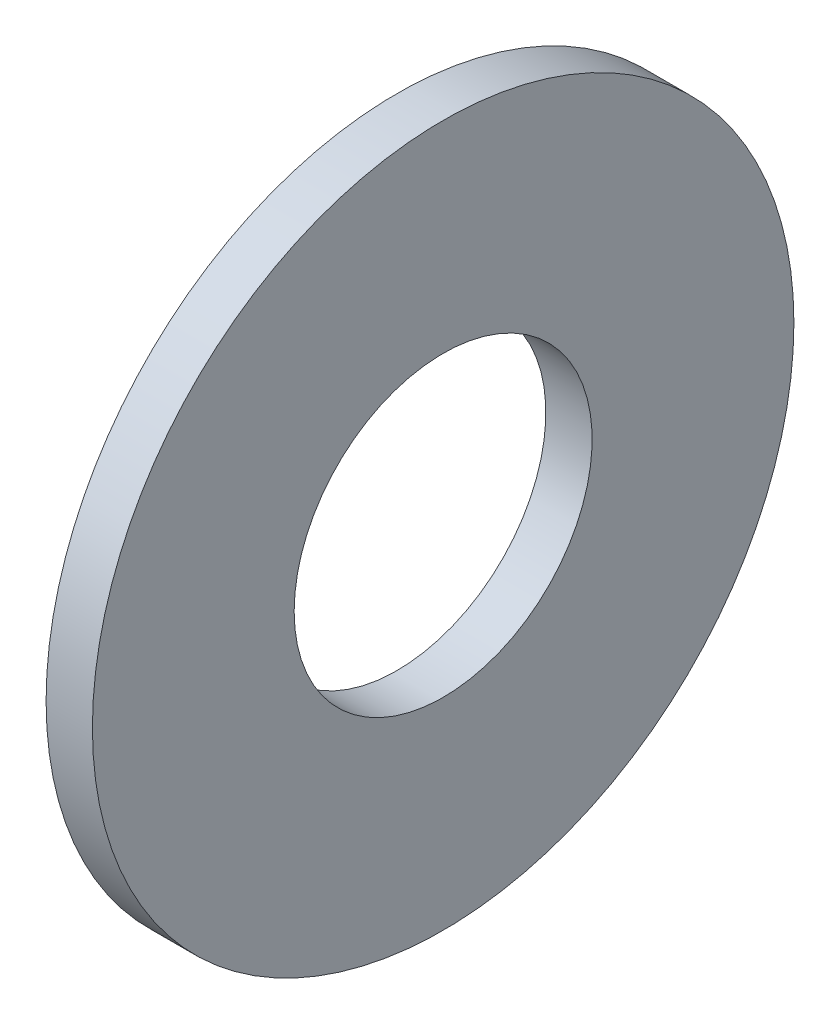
SolidWorks part; units mm, degrees
ref_plane "Plane1" through (0, 0, 0) normal (0, 0, 1) x (1, 0, 0)
ref_plane "Plane2" through (0, 0, 0) normal (0, 1, 0) x (1, 0, 0)
ref_plane "Plane3" through (0, 0, 0) normal (1, 0, 0) x (0, 0, -1)
other "Configuration Table"
sketch "Sketch1" plane through (0, 0, 0) normal (0, 0, 1) x (1, 0, 0)
  line L0 (-34.925, 0) -> (9.525, 0) construction
  line L1 (0, 13.4874) -> (0, 31.75)
  line L2 (0, 31.75) -> (-4.191, 31.75)
  line L3 (-4.191, 31.75) -> (-4.191, 13.4874)
  line L4 (-4.191, 13.4874) -> (0, 13.4874)
  dimension "Thickness" = 4.191
  dimension "Inside_dia" = 26.9748
  dimension "Outside_dia" = 63.5
revolve "Base-Revolve" add sketch "Sketch1" angle 360 about L0
